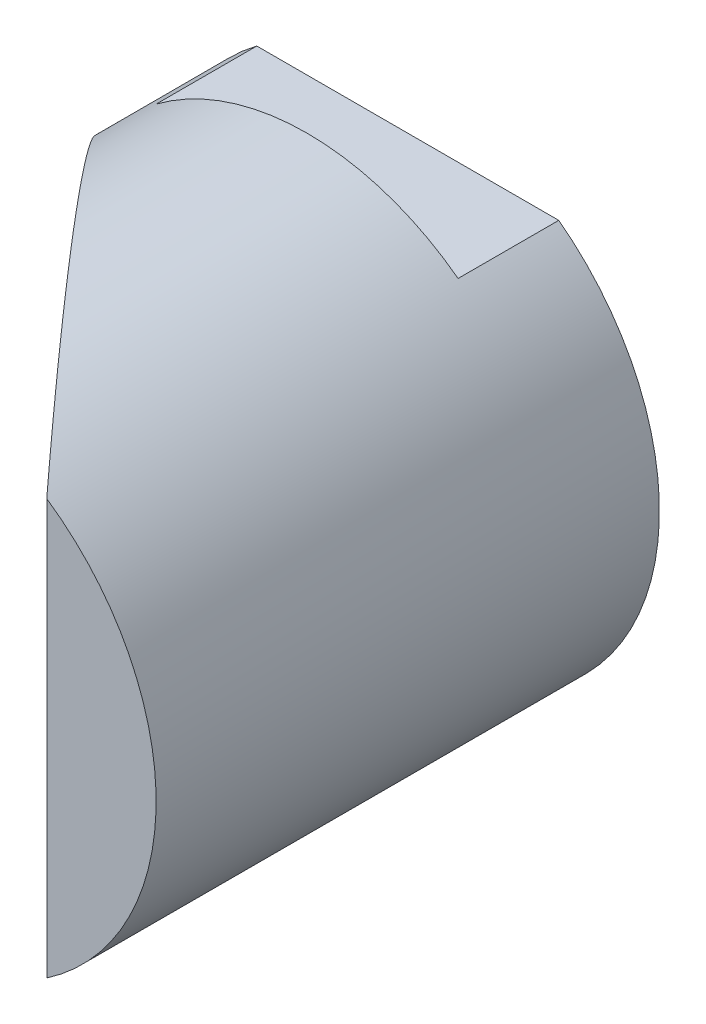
SolidWorks part; units mm, degrees
ref_plane "Front Plane" through (0, 0, 0) normal (0, 0, 1) x (1, 0, 0)
ref_plane "Top Plane" through (0, 0, 0) normal (0, 1, 0) x (1, 0, 0)
ref_plane "Right Plane" through (0, 0, 0) normal (1, 0, 0) x (0, 0, -1)
sketch "Sketch1" plane through (0, 0, 0) normal (0, 0, 1) x (1, 0, 0)
  circle A0 centre (0, 0) radius 15.875
  circle A1 centre (0, 0) radius 4.3688
  dimension "D1" = 31.75
  dimension "D2" = 8.7376
extrude "Boss-Extrude1" add sketch "Sketch1" along normal blind 39.6875
sketch "Sketch2" plane through (0, 0, 0) normal (0, 1, 0) x (1, 0, 0)
  line L0 (15.875, -39.6875) -> (-25.9289, 8.4024)
  line L1 (15.875, -39.6875) -> (-25.9289, -39.6875)
  line L2 (-25.9289, -39.6875) -> (-25.9289, 8.4024)
  dimension "D1" = 49
extrude "Cut-Extrude1" cut sketch "Sketch2" against normal through all and the other way through all
sketch "Sketch3" plane through (0, 0, 0) normal (0, 0, 1) x (1, 0, 0)
  line L0 (0, -12.7) -> (0, 0) construction
  line L1 (20.3269, 21.038) -> (-20.3269, 21.038)
  line L2 (20.3269, 21.038) -> (20.3269, 12.7)
  line L3 (20.3269, 12.7) -> (-20.3269, 12.7)
  line L4 (-20.3269, 21.038) -> (-20.3269, 12.7)
  line L5 (20.3269, -12.7) -> (-20.3269, -12.7)
  line L6 (20.3269, -12.7) -> (20.3269, -20.6238)
  line L7 (20.3269, -20.6238) -> (-20.3269, -20.6238)
  line L8 (-20.3269, -12.7) -> (-20.3269, -20.6238)
  line L9 (0, 12.7) -> (0, 0) construction
  dimension "D1" = 25.4
extrude "Cut-Extrude2" cut sketch "Sketch3" along normal blind 6.35
sketch "Sketch4" plane through (0, 0, 0) normal (0, 1, 0) x (1, 0, 0)
  line L0 (15.875, 0) -> (9.525, 0) construction
  line L1 (28.8323, -49.8112) -> (-26.6301, -49.8112)
  line L2 (28.8323, -49.8112) -> (28.8323, -31.75)
  line L3 (28.8323, -31.75) -> (-26.6301, -31.75)
  line L4 (-26.6301, -49.8112) -> (-26.6301, -31.75)
  dimension "D1" = 31.75
extrude "Cut-Extrude3" cut sketch "Sketch4" against normal through all and the other way through all
equation "\"Buoyancy\"= \"SW-Volume\" * ( \"SW-Density\" - .037062 )"
